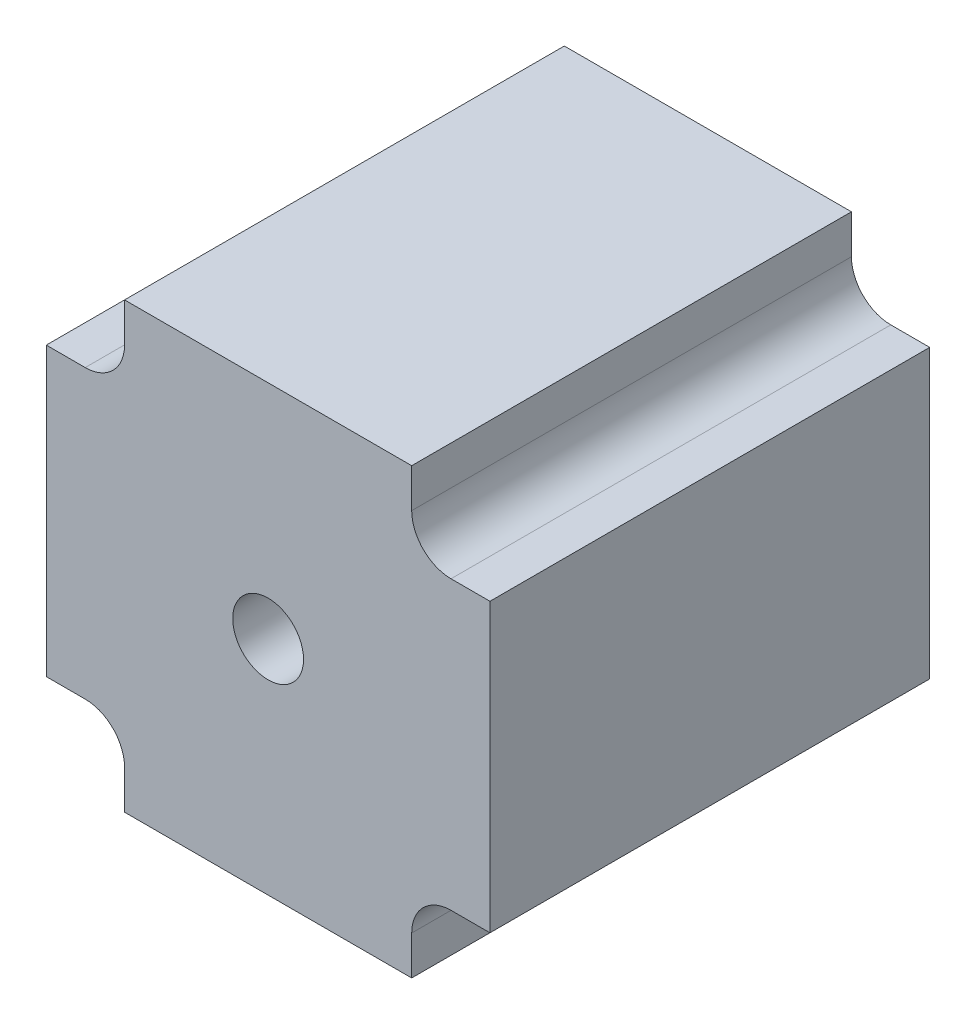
SolidWorks part; units mm, degrees
ref_plane "前视" through (0, 0, 0) normal (0, 0, 1) x (1, 0, 0)
ref_plane "上视" through (0, 0, 0) normal (0, 1, 0) x (1, 0, 0)
ref_plane "右视" through (0, 0, 0) normal (1, 0, 0) x (0, 0, -1)
sketch "草图1" plane through (0, 0, 0) normal (0, 0, 1) x (1, 0, 0)
  line L0 (-18.25, 18.25) -> (-18.25, 28.2)
  line L1 (18.25, -28.2) -> (-18.25, -28.2)
  line L2 (28.2, -18.25) -> (28.2, 18.25)
  line L3 (18.25, 28.2) -> (-18.25, 28.2)
  line L4 (-28.2, -18.25) -> (-28.2, 18.25)
  line L5 (28.2, -28.2) -> (-28.2, 28.2) construction
  line L6 (28.2, 28.2) -> (-28.2, -28.2) construction
  line L7 (28.2, -18.25) -> (18.25, -18.25)
  line L9 (28.2, 18.25) -> (18.25, 18.25)
  line L11 (28.2, -18.25) -> (-28.2, 18.25) construction
  line L12 (28.2, 18.25) -> (-28.2, -18.25) construction
  line L14 (18.25, -28.2) -> (18.25, -18.25)
  line L16 (-18.25, -28.2) -> (-18.25, -18.25)
  line L17 (18.25, -28.2) -> (-18.25, 28.2) construction
  line L18 (18.25, 28.2) -> (-18.25, -28.2) construction
  line L19 (-18.25, 18.25) -> (-28.2, 18.25)
  line L20 (18.25, 18.25) -> (18.25, 28.2)
  line L21 (-18.25, -18.25) -> (-28.2, -18.25)
  point P0 (0, 0)
  point P6 (0, 0)
  point P11 (0, 0)
  dimension "D1" = 56.4
  dimension "D2" = 56.4
  dimension "D3" = 36.5
  dimension "D4" = 36.5
extrude "凸台-拉伸1" add sketch "草图1" along normal blind 55.9
sketch "草图2" plane through (0, 0, 55.9) normal (0, 0, 1) x (1, 0, 0)
  circle A0 centre (0, 0) radius 4.5
extrude "切除-拉伸1" cut sketch "草图2" against normal blind 55.9
fillet "圆角1" radius 5 4 edges at (-18.25, -18.25, 27.95) (18.25, -18.25, 27.95) (18.25, 18.25, 27.95) (-18.25, 18.25, 27.95)
